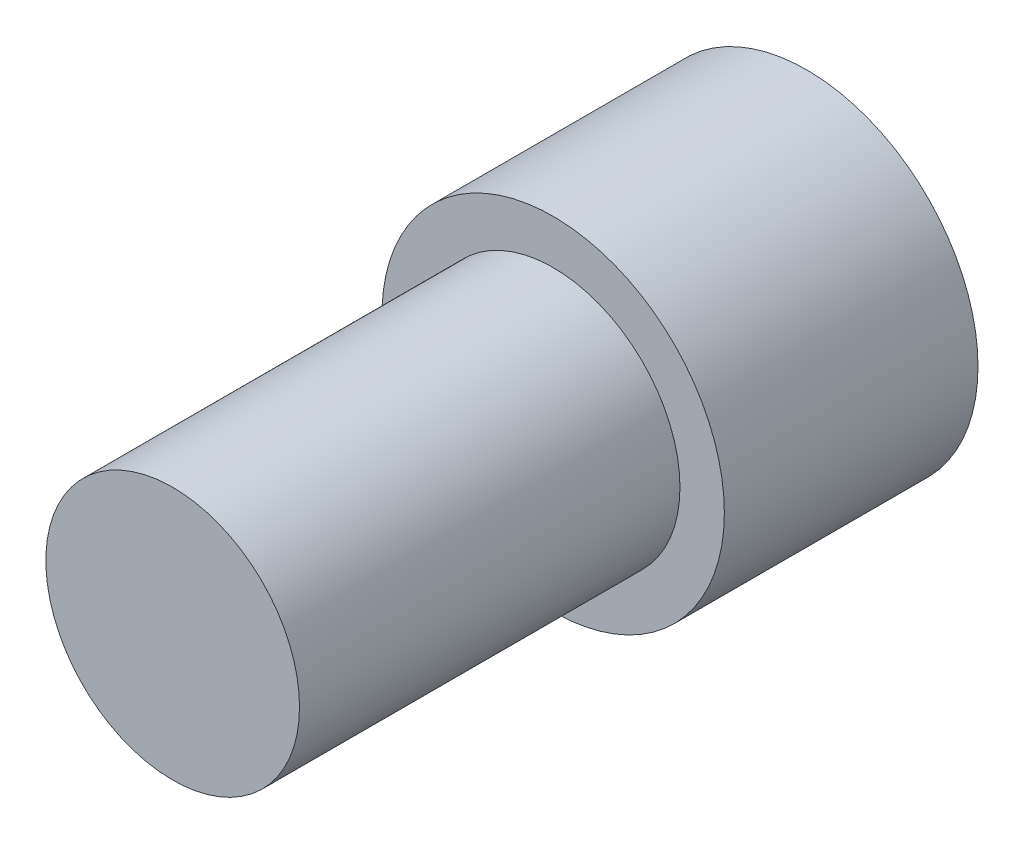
SolidWorks part; units mm, degrees
ref_plane "Piano frontale" through (0, 0, 0) normal (0, 0, 1) x (1, 0, 0)
ref_plane "Piano superiore" through (0, 0, 0) normal (0, 1, 0) x (1, 0, 0)
ref_plane "Piano destro" through (0, 0, 0) normal (1, 0, 0) x (0, 0, -1)
sketch "Schizzo1" plane through (0, 0, 0) normal (0, 0, 1) x (1, 0, 0)
  circle A0 centre (0, 0) radius 13.5
  dimension "D1" = 27
extrude "Estrusione-Estrusione1" add sketch "Schizzo1" along normal blind 20
sketch "Schizzo2" plane through (0, 0, 20) normal (0, 0, 1) x (1, 0, 0)
  circle A0 centre (0, 0) radius 10
  dimension "D1" = 20
extrude "Estrusione-Estrusione2" add sketch "Schizzo2" along normal blind 30
